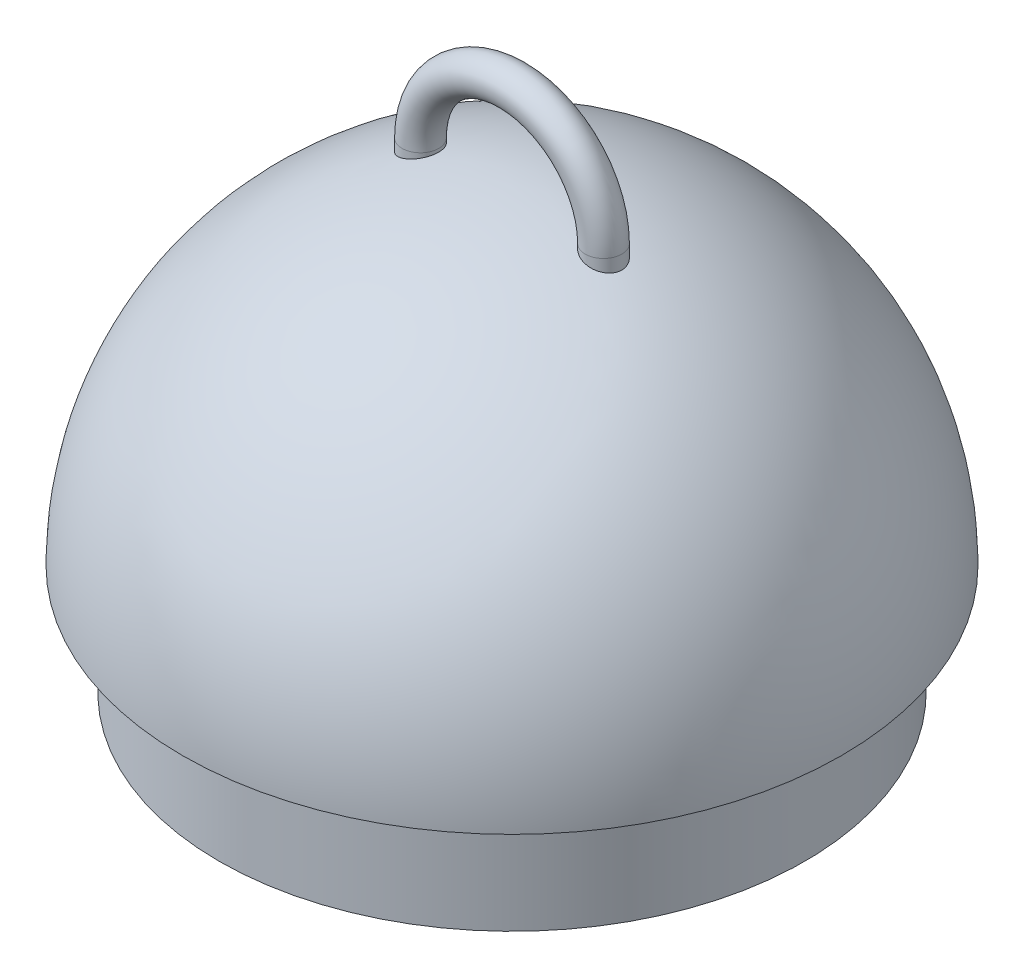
SolidWorks part; units mm, degrees
ref_plane "Front Plane" through (0, 0, 0) normal (0, 0, 1) x (1, 0, 0)
ref_plane "Top Plane" through (0, 0, 0) normal (0, 1, 0) x (1, 0, 0)
ref_plane "Right Plane" through (0, 0, 0) normal (1, 0, 0) x (0, 0, -1)
sketch "Sketch1" plane through (0, 0, 0) normal (0, 1, 0) x (1, 0, 0)
  circle A0 centre (0, 0) radius 80
  dimension "D1" = 160
extrude "Case Mate" add sketch "Sketch1" along normal blind 30
sketch "Sketch2" plane through (0, 30, 0) normal (0, 1, 0) x (1, 0, 0)
  line L0 (90, 0) -> (-90, 0)
  arc A1 (90, 0) -> (-90, 0) centre (0, 0) ccw
  dimension "D1" = 180
revolve "Circular Cap" add sketch "Sketch2" angle 180 about L0
sketch "Sketch3" plane through (0, 0, 0) normal (0, -1, 0) x (-1, 0, 0)
  line L0 (-25, 0) -> (25, 0) construction
  circle A0 centre (25, 0) radius 5
  circle A1 centre (-25, 0) radius 5
  circle A3 centre (0, 0) radius 80 construction
  dimension "D1" = 10
  dimension "D2" = 10
  dimension "D4" = 25
  dimension "D5" = 25
  dimension "D6" = 0
  dimension "D3" = 50
extrude "Ring Base" add sketch "Sketch3" against normal blind 118.618
sketch "Sketch4" plane through (0, 118.618, 0) normal (0, 1, 0) x (1, 0, 0)
  line L0 (0, 0) -> (0, 21.9664) construction
  circle A0 centre (-25, 0) radius 5
  dimension "D1" = 10
revolve "Ring Revolve" add sketch "Sketch4" angle 180 about L0
